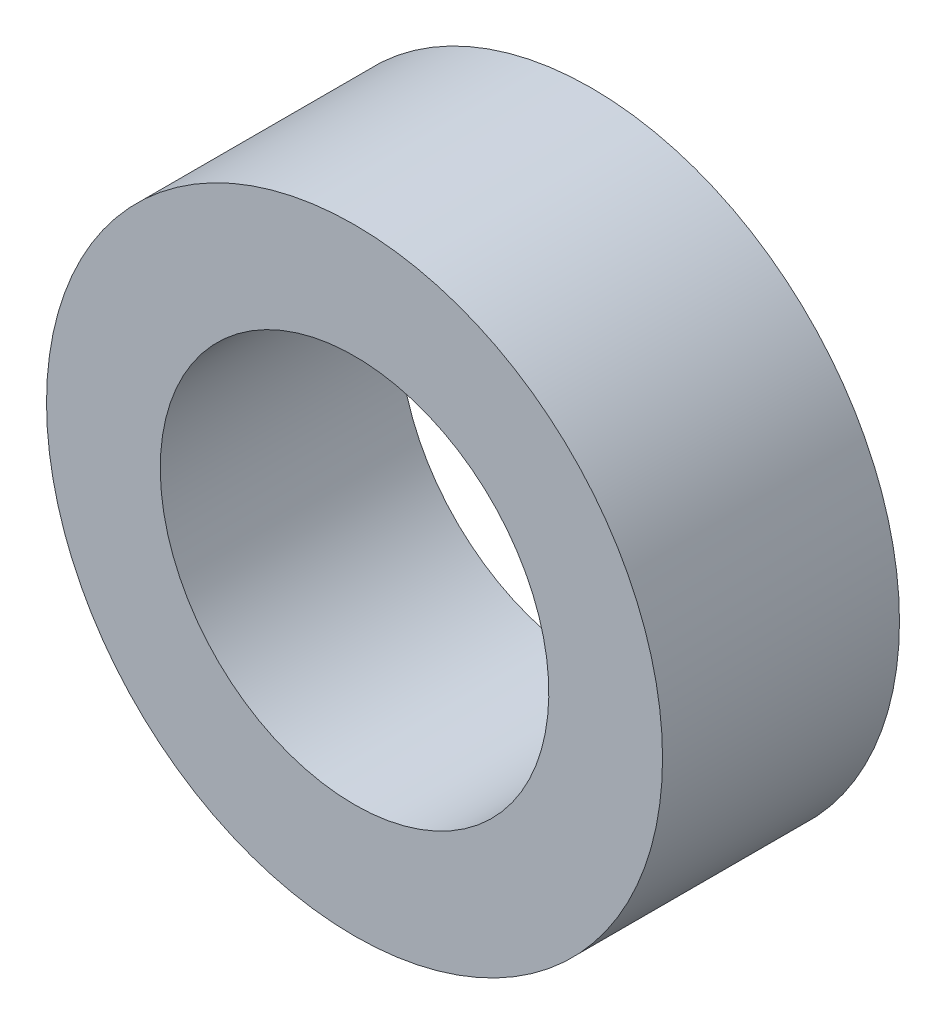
SolidWorks part; units mm, degrees
ref_plane "Front Plane" through (0, 0, 0) normal (0, 0, 1) x (1, 0, 0)
ref_plane "Top Plane" through (0, 0, 0) normal (0, 1, 0) x (1, 0, 0)
ref_plane "Right Plane" through (0, 0, 0) normal (1, 0, 0) x (0, 0, -1)
sketch "Sketch1" plane through (0, 0, 0) normal (0, 0, 1) x (1, 0, 0)
  circle A1 centre (-172.4758, 535.6932) radius 4.1
  arc A4 (-175.4928, 540.0622) -> (-169.4589, 531.3241) centre (-172.4758, 535.6932) ccw
  arc A5 (-169.4589, 531.3241) -> (-175.4928, 540.0622) centre (-172.4758, 535.6932) ccw
extrude "Boss-Extrude1" add sketch "Sketch1" along normal up to surface (5.05 mm away)
sketch "Sketch2" plane through (0, 0, 5.05) normal (0, 0, 1) x (1, 0, 0)
  circle A0 centre (-172.4758, 535.6932) radius 5.3095 construction
  circle A1 centre (-172.4758, 535.6932) radius 4.1 construction
  circle A2 centre (-172.4758, 535.6932) radius 5.3095
  circle A3 centre (-172.4758, 535.6932) radius 4.1
  dimension "D1" = 8.2
  dimension "D2" = 10.619
sketch "Sketch3" plane through (0, 0, 0) normal (1, 0, 0) x (0, 0, -1)
  line L0 (-5.05, 535.6932) -> (0, 535.6932)
  line L1 (-5.05, 541.0026) -> (-5.05, 530.3837) construction
  line L2 (0, 530.3837) -> (0, 541.0026) construction
  dimension "D1" = 5.05
sketch "Sketch4" plane through (0, 0, 5.05) normal (0, 0, 1) x (1, 0, 0)
  circle A0 centre (-172.4758, 535.6932) radius 4.1
  circle A1 centre (-172.4758, 535.6932) radius 6.5
extrude "Boss-Extrude2" add sketch "Sketch4" against normal blind 5
